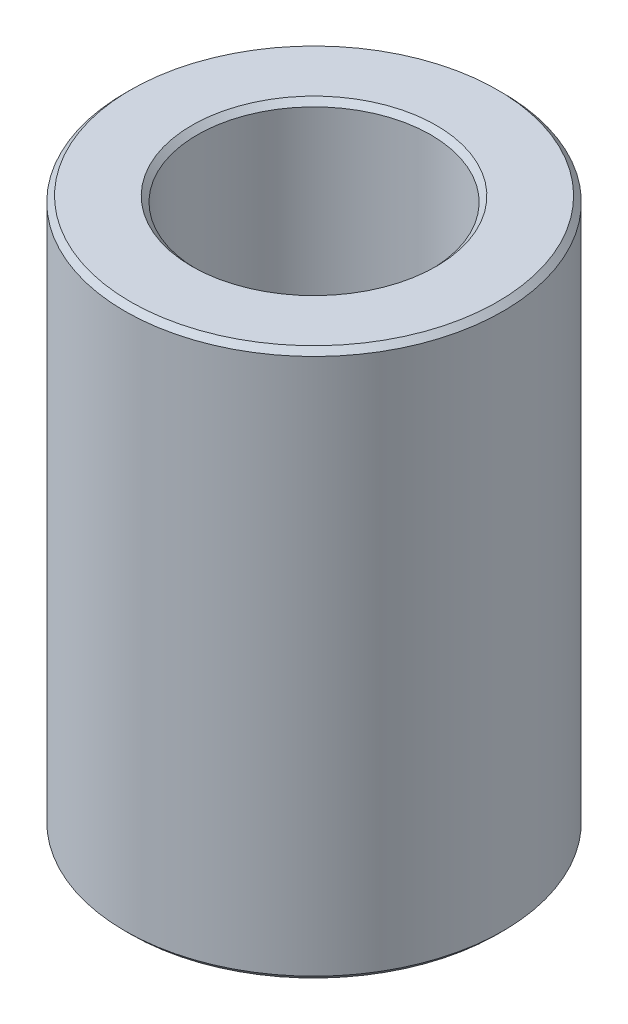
SolidWorks part; units mm, degrees
ref_plane "Front Plane" through (0, 0, 0) normal (0, 0, 1) x (1, 0, 0)
ref_plane "Top Plane" through (0, 0, 0) normal (0, 1, 0) x (1, 0, 0)
ref_plane "Right Plane" through (0, 0, 0) normal (1, 0, 0) x (0, 0, -1)
sketch "Sketch2" plane through (0, 0, 0) normal (0, 1, 0) x (1, 0, 0)
  circle A0 centre (0, 0) radius 8.636
  dimension "D1" = 17.272
extrude "Extrude-Thin1" add sketch "Sketch2" along normal mid plane 25.02 thin
chamfer "Chamfer1" distance 0.25 angle 45 4 edges at (5.334, -12.51, 0) (0, -12.51, 8.636) (5.334, 12.51, 0) (0, 12.51, 8.636)
